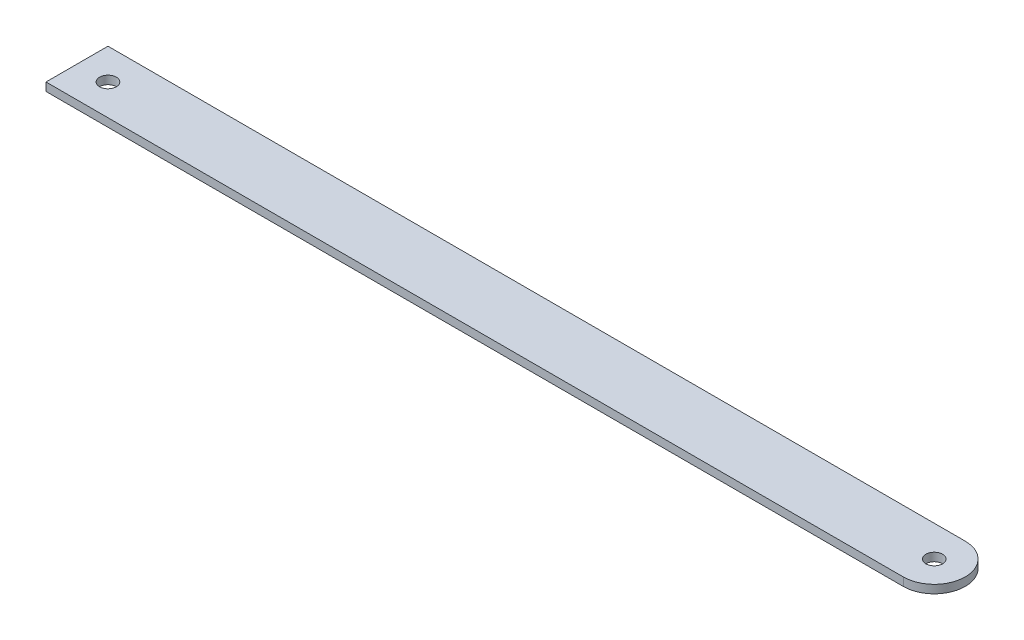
SolidWorks part; units mm, degrees
other "<Rotaladef06>-<Estrusione-Estrusione1>"
ref_plane "Piano frontale" through (0, 0, 0) normal (0, 0, 1) x (1, 0, 0)
ref_plane "Piano superiore" through (0, 0, 0) normal (0, 1, 0) x (1, 0, 0)
ref_plane "Piano destro" through (0, 0, 0) normal (1, 0, 0) x (0, 0, -1)
mirrored part "Rotaladef06_Specchiato"
